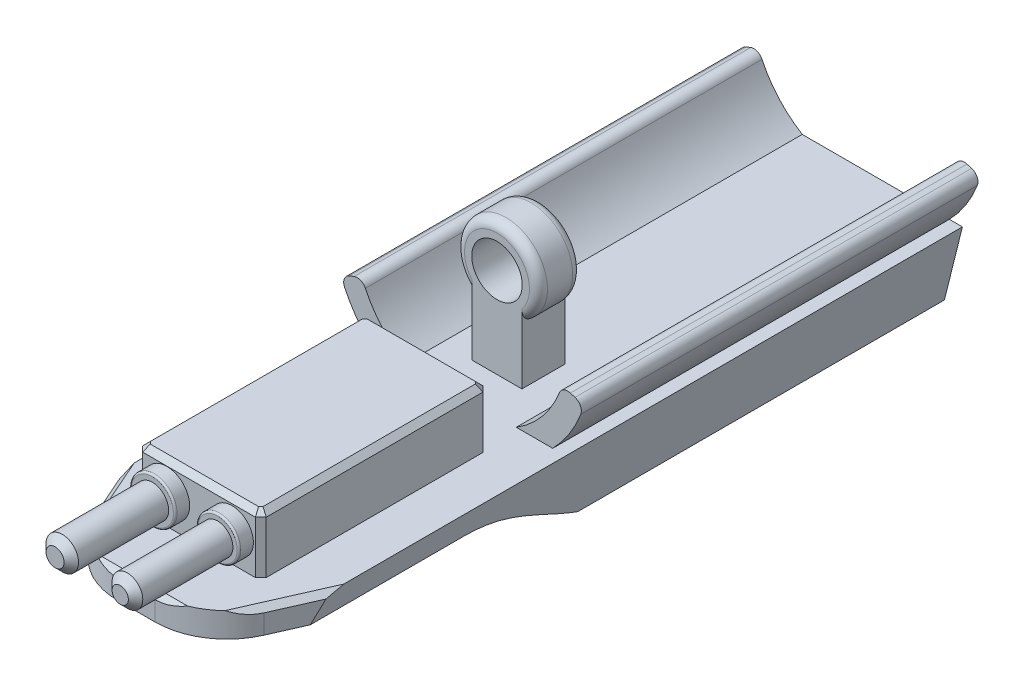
SolidWorks part; units mm, degrees
ref_plane "Front Plane" through (0, 0, 0) normal (0, 0, 1) x (1, 0, 0)
ref_plane "Top Plane" through (0, 0, 0) normal (0, 1, 0) x (1, 0, 0)
ref_plane "Right Plane" through (0, 0, 0) normal (1, 0, 0) x (0, 0, -1)
sketch "Sketch1" plane through (0, 0, 0) normal (0, 0, 1) x (1, 0, 0)
  line L0 (6.9199, -9.1851) -> (6.9199, -24.9859)
  line L3 (-6.9199, -24.9859) -> (6.9199, -24.9859)
  line L9 (-6.9199, -9.1851) -> (-6.9199, -24.9859)
  circle A0 centre (0, 0) radius 7
  arc A1 (6.9199, -9.1851) -> (-6.9199, -9.1851) centre (0, 0) ccw
  point P4 (0, -11.5)
extrude "Boss-Extrude1" add sketch "Sketch1" along normal blind 12
fillet "Fillet1" radius 2.5 2 edges at (0, 11.5, 0) (0, 11.5, 12)
sketch "Sketch2" plane through (0, -24.9859, 0) normal (0, -1, 0) x (1, 0, 0)
  line L0 (0, 12) -> (0, 112)
  line L1 (-6.9199, 12) -> (6.9199, 12) construction
  line L3 (-36.8203, -88) -> (36.8203, -88)
  line L4 (-36.8203, -88) -> (-36.8203, 112)
  line L5 (-36.8203, 112) -> (36.8203, 112)
  line L6 (36.8203, -88) -> (36.8203, 112)
  line L7 (-36.8203, -88) -> (36.8203, 112) construction
  line L8 (-36.8203, 112) -> (36.8203, -88) construction
extrude "Boss-Extrude2" add sketch "Sketch2" along normal blind 22
sketch "Sketch3" plane through (36.8203, 0, 0) normal (1, 0, 0) x (0, 0, -1)
  line L0 (-112, -31.8504) -> (-48.3987, -31.8504)
  line L1 (-112, -46.9859) -> (-112, -24.9859) construction
  line L2 (88, -46.9859) -> (-112, -46.9859) construction
  line L3 (-112, -31.8504) -> (-112, -46.9859)
  line L4 (-112, -46.9859) -> (-8.4055, -46.9859)
  spline S0 degree 3 poles (-48.3987, -31.8504) (-33.3915, -31.8498) (-22.0654, -42.8467) (-8.4055, -46.9859) knots 0 0 0 0 1 1 1 1
extrude "Cut-Extrude1" cut sketch "Sketch3" against normal blind 110
sketch "Sketch4" plane through (0, 0, 112) normal (0, 0, 1) x (1, 0, 0)
  line L0 (0, -24.9859) -> (0, -46.9859)
  line L1 (-36.8203, -24.9859) -> (36.8203, -24.9859) construction
  line L2 (-36.8203, -46.9859) -> (36.8203, -46.9859) construction
  line L3 (23.5969, -46.9859) -> (-23.5969, -46.9859)
  line L4 (36.8203, -31.8504) -> (36.8203, -57.9287)
  line L5 (36.8203, -57.9287) -> (-36.8203, -57.9287)
  line L6 (0, -57.9287) -> (0, -46.9859)
  line L7 (-36.8203, -31.8504) -> (-36.8203, -57.9287)
  spline S0 degree 2 poles (23.5969, -46.9859) (33.2393, -42.2972) (36.8203, -31.8504) knots 0 0 0 1 1 1
  spline S1 degree 2 poles (-23.5969, -46.9859) (-33.2393, -42.2972) (-36.8203, -31.8504) knots 0 0 0 1 1 1
extrude "Cut-Extrude2" cut sketch "Sketch4" against normal blind 219 contours L3 S1 L7 L5 L6 | S0 L3 L6 L5 L4
sketch "Sketch5" plane through (0, -46.9859, 0) normal (0, -1, 0) x (1, 0, 0)
  line L0 (0, 112) -> (0, 48.3987)
  line L1 (-36.8203, 112) -> (36.8203, 112) construction
  line L2 (-36.8203, 48.3987) -> (36.8203, 48.3987) construction
  line L3 (0, 112) -> (-18.1651, 112)
  line L4 (-18.1651, 112) -> (-36.8203, 69.7217)
  line L5 (-36.8203, 112) -> (-36.8203, 48.3987) construction
  line L6 (-36.8203, 69.7217) -> (-36.8203, 48.3987)
  line L7 (-36.8203, 48.3987) -> (-51.8301, 48.3987)
  line L8 (-51.8301, 48.3987) -> (-51.8301, 112)
  line L9 (-51.8301, 112) -> (-18.1651, 112)
  line L10 (36.8203, 69.7217) -> (36.8203, 48.3987)
  line L11 (36.8203, 48.3987) -> (51.8301, 48.3987)
  line L12 (51.8301, 48.3987) -> (51.8301, 112)
  line L13 (51.8301, 112) -> (18.1651, 112)
  line L14 (18.1651, 112) -> (36.8203, 69.7217)
extrude "Cut-Extrude3" cut sketch "Sketch5" against normal blind 219 contours L9 L8 L7 L6 L4 | L13 L14 L10 L11 L12
sketch "Sketch6" plane through (0, 0, -88) normal (0, 0, -1) x (-1, 0, 0)
  line L0 (0, -24.9859) -> (0, 0)
  line L2 (36.8203, -24.9859) -> (-36.8203, -24.9859) construction
  line L3 (-34.1076, -10.414) -> (-28.0425, -8.5622)
  line L4 (27.4088, -10.414) -> (33.3368, -12.6664)
  arc A0 (-28.0425, -8.5622) -> (27.4088, -10.414) centre (0, 0) ccw
  arc A1 (-34.1076, -10.414) -> (33.3368, -12.6664) centre (0, 0) ccw
extrude "Boss-Extrude3" add sketch "Sketch6" against normal blind 110 contours L3 A1 A0 M5 | A1 L4 A0 M5
fillet "Fillet2" radius 2.5 4 edges at (-33.3368, -12.6664, -33) (-27.4088, -10.414, -33) (28.0425, -8.5622, -33) (34.1076, -10.414, -33)
chamfer "Chamfer1" distance 1.5 angle 45 5 edges at (-36.8203, -24.9859, -9.1391) (-27.4927, -24.9859, 90.8609) (0, -24.9859, 112) (27.4927, -24.9859, 90.8609) (36.8203, -24.9859, -9.1391)
fillet "Fillet3" radius 20 4 edges at (-36.8203, -29.1681, 69.7217) (-18.1651, -29.1681, 112) (18.1651, -29.1681, 112) (36.8203, -29.1681, 69.7217)
sketch "Sketch7" plane through (0, 0, -88) normal (0, 0, -1) x (-1, 0, 0)
  line L1 (-11.7467, -44.1157) -> (11.7467, -44.1157)
  line L2 (-11.7467, -44.1157) -> (-11.7467, -34.3052)
  line L3 (-11.7467, -34.3052) -> (11.7467, -34.3052)
  line L4 (11.7467, -44.1157) -> (11.7467, -34.3052)
  line L5 (-11.7467, -44.1157) -> (11.7467, -34.3052) construction
  line L6 (-11.7467, -34.3052) -> (11.7467, -44.1157) construction
  point P0 (0, -39.2105)
extrude "Boss-Extrude4" add sketch "Sketch7" against normal blind 149
chamfer "Chamfer2" distance 2.5 angle 45 4 edges at (-11.7467, -34.3052, 48.4045) (11.7467, -34.3052, 48.4045) (11.7467, -44.1157, 38.3732) (-11.7467, -44.1157, 38.3732)
sketch "Sketch8" plane through (0, -46.9859, 0) normal (0, -1, 0) x (1, 0, 0)
  line L1 (-17.4886, -51.745) -> (17.4886, -51.745)
  line L2 (-17.4886, -51.745) -> (-17.4886, 2.6291)
  line L3 (-17.4886, 2.6291) -> (17.4886, 2.6291)
  line L4 (17.4886, -51.745) -> (17.4886, 2.6291)
  line L5 (-17.4886, -51.745) -> (17.4886, 2.6291) construction
  line L6 (-17.4886, 2.6291) -> (17.4886, -51.745) construction
  point P0 (0, -24.558)
extrude "Cut-Extrude4" cut sketch "Sketch8" against normal blind 3
sketch "Sketch9" plane through (0, -46.9859, 0) normal (0, -1, 0) x (1, 0, 0)
  line L0 (17.4886, 2.6291) -> (17.4886, -51.745)
  line L1 (17.4886, -51.745) -> (-17.4886, -51.745)
  line L2 (-17.4886, -51.745) -> (-17.4886, 2.6291)
  line L3 (-17.4886, 2.6291) -> (17.4886, 2.6291)
  line L5 (-19.3616, -53.4051) -> (19.3616, -53.4051)
  line L6 (-19.3616, -53.4051) -> (-19.3616, 4.2892)
  line L7 (-19.3616, 4.2892) -> (19.3616, 4.2892)
  line L8 (19.3616, -53.4051) -> (19.3616, 4.2892)
  line L9 (-19.3616, -53.4051) -> (19.3616, 4.2892) construction
  line L10 (-19.3616, 4.2892) -> (19.3616, -53.4051) construction
  point P6 (0, -24.558)
extrude "Boss-Extrude5" add sketch "Sketch9" along normal blind 2
fillet "Fillet4" radius 0.5 8 edges at (-17.4886, -48.9859, -24.558) (0, -48.9859, -51.745) (17.4886, -48.9859, -24.558) (0, -48.9859, 2.6291) (0, -48.9859, -53.4051) (-19.3616, -48.9859, -24.558) (0, -48.9859, 4.2892) (19.3616, -48.9859, -24.558)
sketch "Sketch10" plane through (0, -46.9859, 0) normal (0, -1, 0) x (1, 0, 0)
  circle A0 centre (6.1166, -65.2847) radius 8.5069
  circle A1 centre (-10.6796, -65.2847) radius 4.8815
extrude "Boss-Extrude6" add sketch "Sketch10" along normal blind 2
chamfer "Chamfer3" distance 2 angle 45 2 edges at (-10.6796, -48.9859, -70.1663) (6.1166, -48.9859, -73.7916)
sketch "Sketch11" plane through (0, -46.9859, 0) normal (0, -1, 0) x (1, 0, 0)
  line L0 (-23.5969, -88) -> (23.5969, -88) construction
  line L1 (-15.7069, -95.7976) -> (15.7069, -95.7976)
  line L2 (-15.7069, -95.7976) -> (-15.7069, -82.7024)
  line L3 (-13.2069, -80.2024) -> (13.2069, -80.2024)
  line L4 (15.7069, -95.7976) -> (15.7069, -82.7024)
  line L5 (-15.7069, -95.7976) -> (15.7069, -80.2024) construction
  line L6 (-15.7069, -80.2024) -> (15.7069, -95.7976) construction
  arc A0 (-15.7069, -82.7024) -> (-13.2069, -80.2024) centre (-13.2069, -82.7024) cw
  arc A1 (15.7069, -82.7024) -> (13.2069, -80.2024) centre (13.2069, -82.7024) ccw
  point P0 (0, -88)
  dimension "D1" = 2.5
  dimension "D2" = 2.5
extrude "Cut-Extrude5" cut sketch "Sketch11" against normal blind 3
sketch "Sketch12" plane through (0, -24.9859, 0) normal (0, 1, 0) x (1, 0, 0)
  line L0 (-17.5065, -31.164) -> (16.7665, -31.164)
  line L1 (16.7665, -31.164) -> (16.7665, -94.2765)
  line L2 (16.7665, -94.2765) -> (-17.5065, -94.2765)
  line L3 (-17.5065, -94.2765) -> (-17.5065, -31.164)
extrude "Boss-Extrude7" add sketch "Sketch12" along normal blind 16
sketch "Sketch13" plane through (0, 0, 94.2765) normal (0, 0, 1) x (1, 0, 0)
  circle A0 centre (-9.2941, -16.8787) radius 4.5087
  circle A1 centre (8.7778, -16.8787) radius 4.2598
extrude "Boss-Extrude8" add sketch "Sketch13" along normal blind 31
sketch "Sketch14" plane through (0, 0, 94.2765) normal (0, 0, 1) x (1, 0, 0)
  circle A0 centre (-9.2941, -16.8787) radius 6.3291
  circle A1 centre (8.7778, -16.8787) radius 5.9379
extrude "Boss-Extrude9" add sketch "Sketch14" along normal blind 4
chamfer "Chamfer4" distance 2 angle 45 2 edges at (-4.7854, -16.8787, 125.2765) (13.0376, -16.8787, 125.2765)
fillet "Fillet5" radius 0.5 2 edges at (-2.965, -16.8787, 98.2765) (14.7157, -16.8787, 98.2765)
chamfer "Chamfer5" distance 1.5 angle 45 4 edges at (-17.5065, -16.9859, 31.164) (16.7665, -16.9859, 31.164) (-17.5065, -16.9859, 94.2765) (16.7665, -16.9859, 94.2765)
chamfer "Chamfer6" distance 1.5 angle 45 8 edges at (16.0165, -8.9859, 31.914) (16.7665, -8.9859, 62.7203) (16.0165, -8.9859, 93.5265) (-0.37, -8.9859, 94.2765) (-16.7565, -8.9859, 93.5265) (-17.5065, -8.9859, 62.7203) (-16.7565, -8.9859, 31.914) (-0.37, -8.9859, 31.164)
sketch "Sketch16" plane through (0, 0, -88) normal (0, 0, -1) x (-1, 0, 0)
  line L0 (0, -24.9859) -> (0, -43.9859)
  line L1 (6.9199, -24.9859) -> (-6.9199, -24.9859) construction
  line L2 (-15.7069, -43.9859) -> (15.7069, -43.9859) construction
  line L3 (-29.0742, -24.9859) -> (-23.5969, -46.9859)
  line L4 (-25.4457, -24.9859) -> (-35.3203, -24.9859) construction
  line L5 (-23.5969, -46.9859) -> (-41.4955, -46.9859)
  line L6 (-41.4955, -46.9859) -> (-41.4955, -24.9859)
  line L7 (-41.4955, -24.9859) -> (-29.0742, -24.9859)
  line L8 (41.4955, -24.9859) -> (29.0742, -24.9859)
  line L9 (41.4955, -46.9859) -> (41.4955, -24.9859)
  line L10 (23.5969, -46.9859) -> (41.4955, -46.9859)
  line L11 (29.0742, -24.9859) -> (23.5969, -46.9859)
extrude "Cut-Extrude7" cut sketch "Sketch16" against normal blind 210 contours L11 M12 M9 M10 M11 | L3 M24 M25 M26 M27
chamfer "Chamfer7" distance 2 angle 45 2 edges at (-23.5969, -46.9859, -39.7972) (23.5969, -46.9859, -39.7972)
sketch "Sketch17" plane through (0, 0, 61) normal (0, 0, 1) x (1, 0, 0)
  line L8 (-8.5, -42.7105) -> (8.5, -42.7105)
  line L9 (-8.5, -42.7105) -> (-8.5, -35.7105)
  line L10 (-8.5, -35.7105) -> (8.5, -35.7105)
  line L11 (8.5, -42.7105) -> (8.5, -35.7105)
extrude "Cut-Extrude8" cut sketch "Sketch17" against normal blind 120
